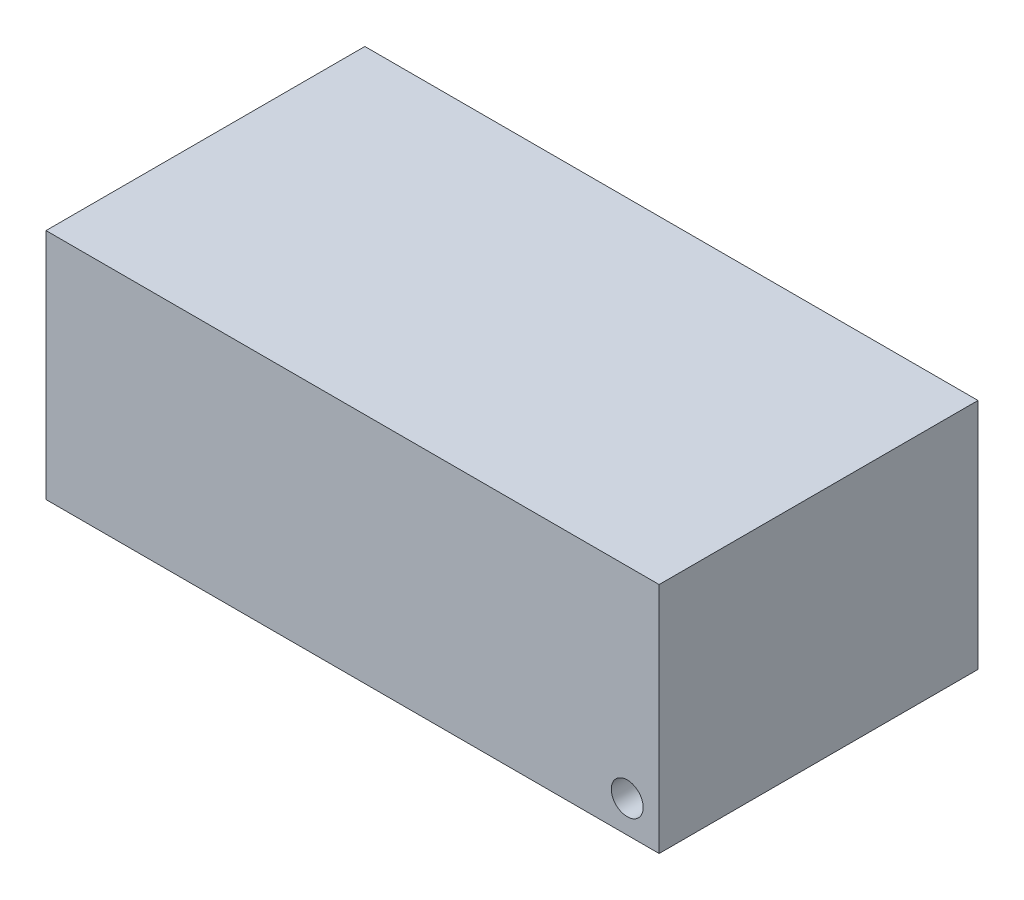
SolidWorks part; units mm, degrees
ref_plane "Ebene vorne" through (0, 0, 0) normal (0, 0, 1) x (1, 0, 0)
ref_plane "Ebene oben" through (0, 0, 0) normal (0, 1, 0) x (1, 0, 0)
ref_plane "Ebene rechts" through (0, 0, 0) normal (1, 0, 0) x (0, 0, -1)
sketch "Skizze1" plane through (0, 0, 0) normal (0, 0, 1) x (1, 0, 0)
  line L1 (-48.0714, -18.2643) -> (48.0714, -18.2643)
  line L2 (-48.0714, -18.2643) -> (-48.0714, 18.2643)
  line L3 (-48.0714, 18.2643) -> (48.0714, 18.2643)
  line L4 (48.0714, -18.2643) -> (48.0714, 18.2643)
  line L5 (-48.0714, -18.2643) -> (48.0714, 18.2643) construction
  line L6 (-48.0714, 18.2643) -> (48.0714, -18.2643) construction
  point P0 (0, 0)
extrude "Linear austragen1" add sketch "Skizze1" along normal blind 50
sketch "Skizze2" plane through (0, 0, 50) normal (0, 0, 1) x (1, 0, 0)
  line L0 (-48.0714, -18.2643) -> (48.0714, -18.2643) construction
  line L1 (48.0714, -18.2643) -> (48.0714, 18.2643) construction
  circle A0 centre (43.0714, -13.2643) radius 2.5
  dimension "D1" = 5
  dimension "D2" = 5
  dimension "D3" = 5
extrude "Linear austragen2" cut sketch "Skizze2" against normal through all
